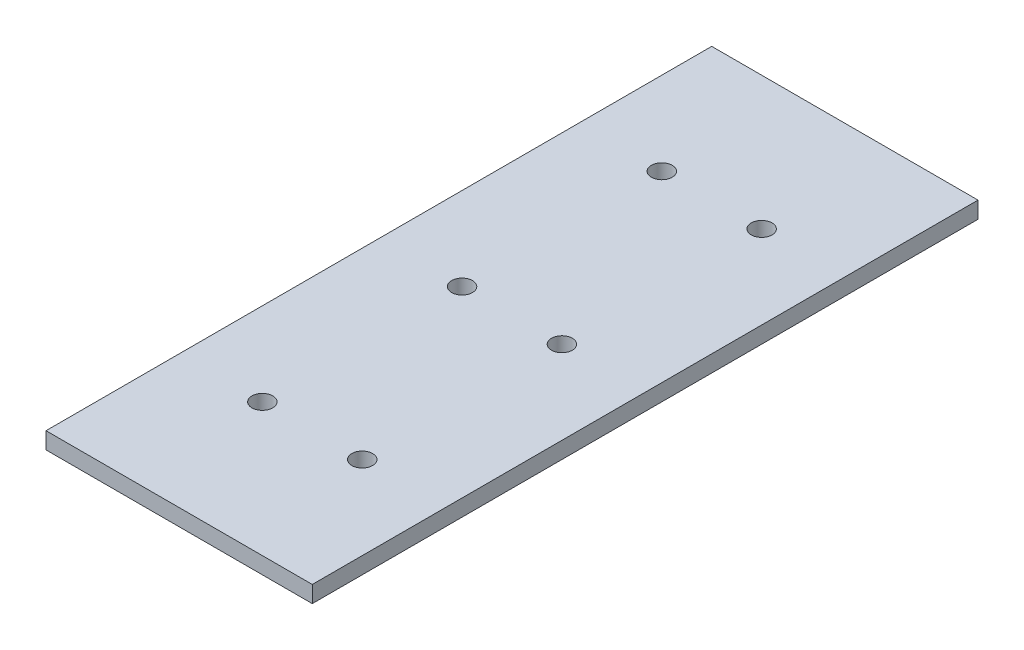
SolidWorks part; units mm, degrees
ref_plane "Front Plane" through (0, 0, 0) normal (0, 0, 1) x (1, 0, 0)
ref_plane "Top Plane" through (0, 0, 0) normal (0, 1, 0) x (1, 0, 0)
ref_plane "Right Plane" through (0, 0, 0) normal (1, 0, 0) x (0, 0, -1)
sketch "Sketch1" plane through (0, 0, 0) normal (0, 0, 1) x (1, 0, 0)
  line L1 (50.8, -3.175) -> (-50.8, -3.175)
  line L2 (50.8, -3.175) -> (50.8, 3.175)
  line L3 (50.8, 3.175) -> (-50.8, 3.175)
  line L4 (-50.8, -3.175) -> (-50.8, 3.175)
  line L5 (50.8, -3.175) -> (-50.8, 3.175) construction
  line L6 (50.8, 3.175) -> (-50.8, -3.175) construction
  point P0 (0, 0)
  dimension "D1" = 6.35
  dimension "D2" = 101.6
extrude "Extrude1" add sketch "Sketch1" along normal blind 254
sketch "Sketch2" plane through (0, 3.175, 0) normal (0, 1, 0) x (1, 0, 0)
  line L0 (-50.8, -254) -> (-50.8, 0) construction
  line L1 (50.8, 0) -> (-50.8, 0) construction
  circle A0 centre (-19.05, -50.8) radius 3.9751
  circle A1 centre (19.05, -50.8) radius 3.9751
  circle A2 centre (-19.05, -127) radius 3.9751
  circle A3 centre (19.05, -127) radius 3.9751
  circle A4 centre (-19.05, -203.2) radius 3.9751
  circle A5 centre (19.05, -203.2) radius 3.9751
  dimension "D1" = 7.9502
  dimension "D2" = 7.9502
  dimension "D3" = 7.9502
  dimension "D4" = 7.9502
  dimension "D5" = 7.9502
  dimension "D6" = 7.9502
  dimension "D7" = 31.75
  dimension "D8" = 31.75
  dimension "D9" = 31.75
  dimension "D10" = 38.1
  dimension "D11" = 38.1
  dimension "D12" = 38.1
  dimension "D13" = 50.8
  dimension "D14" = 50.8
  dimension "D15" = 76.2
  dimension "D16" = 76.2
  dimension "D17" = 76.2
  dimension "D18" = 76.2
extrude "Extrude2" cut sketch "Sketch2" against normal blind 6.35
